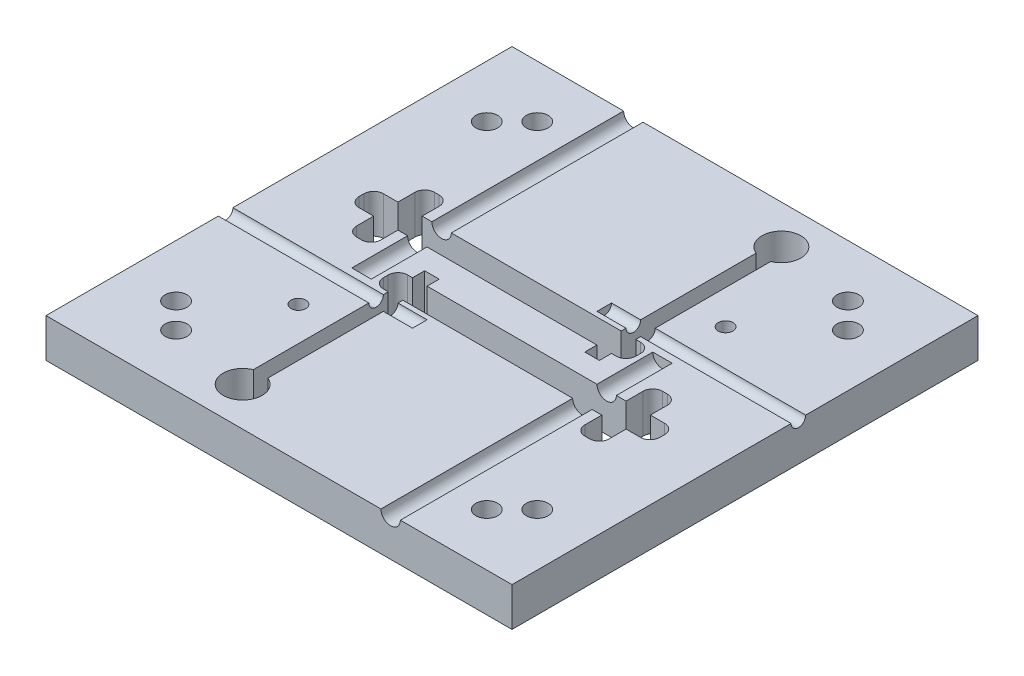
SolidWorks part; units mm, degrees
ref_plane "Front" through (0, 0, 0) normal (0, 0, 1) x (1, 0, 0)
ref_plane "Top" through (0, 0, 0) normal (0, 1, 0) x (1, 0, 0)
ref_plane "Right" through (0, 0, 0) normal (1, 0, 0) x (0, 0, -1)
sketch "Sketch1" plane through (0, 0, 0) normal (0, 1, 0) x (1, 0, 0)
  line L1 (-152.4, -152.4) -> (152.4, -152.4)
  line L2 (-152.4, -152.4) -> (-152.4, 152.4)
  line L3 (-152.4, 152.4) -> (152.4, 152.4)
  line L4 (152.4, -152.4) -> (152.4, 152.4)
  dimension "D1" = 304.8
  dimension "D2" = 304.8
  dimension "D3" = 152.4
  dimension "D4" = 152.4
extrude "Extrude1" add sketch "Sketch1" along normal mid plane 25.4
sketch "Sketch2" plane through (0, 12.7, 0) normal (0, 1, 0) x (-1, 0, 0)
  line L0 (0, 50) -> (0, -50) construction
  line L1 (50, 0) -> (-50, 0) construction
  circle A0 centre (118.11, -101.6) radius 7.1374
  circle A1 centre (-118.11, -101.6) radius 7.1374
  circle A2 centre (-101.6, -118.11) radius 7.1374
  circle A3 centre (101.6, -118.11) radius 7.1374
  dimension "D1" = 14.2748
  dimension "D5" = 14.2748
  dimension "D6" = 14.2748
  dimension "D7" = 101.6
  dimension "D8" = 101.6
  dimension "D9" = 118.11
  dimension "D10" = 118.11
  dimension "D2" = 101.6
  dimension "D3" = 118.11
  dimension "D4" = 118.11
extrude "Cut-Extrude1" cut sketch "Sketch2" against normal through all
mirror "Mirror1" about plane through (0, 0, 0) normal (0, 0, 1) of "Cut-Extrude1"
sketch "Sketch3" plane through (0, 12.7, 0) normal (0, 1, 0) x (-1, 0, 0)
  line L1 (101.6, -44.45) -> (85.725, -44.45)
  line L2 (101.6, -44.45) -> (101.6, 6.35)
  line L3 (101.6, 6.35) -> (85.725, 6.35)
  line L4 (85.725, -44.45) -> (85.725, 6.35)
  dimension "D1" = 50.8
  dimension "D2" = 15.875
  dimension "D3" = 101.6
  dimension "D4" = 44.45
extrude "Cut-Extrude2" cut sketch "Sketch3" against normal through all
fillet "Fillet1" radius 6.35 1 edges at (-101.6, 0, -44.45)
fillet "Fillet2" radius 6.35 1 edges at (-85.725, 0, -44.45)
fillet "Fillet3" radius 6.35 1 edges at (-101.6, 0, 6.35)
fillet "Fillet4" radius 6.35 1 edges at (-85.725, 0, 6.35)
ref_plane "Plane1" through (0, 12.7, 0) normal (0, 1, 0) x (-1, 0, 0)
sketch "Sketch5" plane through (0, 12.7, 0) normal (0, 1, 0) x (-1, 0, 0)
  line L1 (117.475, -11.0998) -> (38.1, -11.0998)
  line L2 (117.475, -11.0998) -> (117.475, -26.9748)
  line L3 (117.475, -26.9748) -> (38.1, -26.9748)
  line L4 (38.1, -11.0998) -> (38.1, -26.9748)
  dimension "D1" = 15.875
  dimension "D2" = 79.375
  dimension "D3" = 38.1
  dimension "D4" = 11.0998
extrude "Cut-Extrude4" cut sketch "Sketch5" against normal through all
fillet "Fillet5" radius 6.35 1 edges at (-117.475, 0, -26.9748)
fillet "Fillet6" radius 6.35 1 edges at (-117.475, 0, -11.0998)
fillet "Fillet7" radius 6.35 1 edges at (-38.1, 0, -26.9748)
fillet "Fillet8" radius 6.35 1 edges at (-38.1, 0, -11.0998)
sketch "Sketch6" plane through (0, 12.7, 0) normal (0, 1, 0) x (-1, 0, 0)
  line L0 (85.725, -11.0998) -> (44.45, -11.0998) construction
  line L1 (65.0875, -11.0998) -> (-63.5, -11.0998)
  line L2 (65.0875, -11.0998) -> (65.0875, -26.9748)
  line L3 (65.0875, -26.9748) -> (-63.5, -26.9748)
  line L4 (-63.5, -11.0998) -> (-63.5, -26.9748)
  dimension "D1" = 15.875
  dimension "D2" = 63.5
extrude "Cut-Extrude5" cut sketch "Sketch6" against normal through all
sketch "Sketch7" plane through (152.4, 0, 0) normal (1, 0, 0) x (0, 0, -1)
  line L0 (-152.4, 12.7) -> (152.4, 12.7) construction
  circle A0 centre (34.925, 12.7) radius 4.7625
  dimension "D2" = 9.525
  dimension "D1" = 34.925
extrude "Cut-Extrude6" cut sketch "Sketch7" against normal blind 127
sketch "Sketch8" plane through (0, 12.7, 0) normal (0, 1, 0) x (-1, 0, 0)
  line L1 (-53.975, -3.175) -> (-44.45, -3.175)
  line L2 (-53.975, -3.175) -> (-53.975, -130.175)
  line L3 (-53.975, -130.175) -> (-44.45, -130.175)
  line L4 (-44.45, -3.175) -> (-44.45, -130.175)
  dimension "D1" = 9.525
  dimension "D2" = 3.175
  dimension "D3" = 44.45
  dimension "D4" = 127
fillet "Fillet9" radius 6.35 1 edges at (63.5, 0, -26.9748)
fillet "Fillet10" radius 6.35 1 edges at (63.5, 0, -11.0998)
extrude "Cut-Extrude9" cut sketch "Sketch8" against normal through all from offset 12.7
sketch "Sketch9" plane through (0, 12.7, 0) normal (0, 1, 0) x (-1, 0, 0)
  circle A0 centre (-49.1998, -127) radius 12.7
  dimension "D1" = 25.4
  dimension "D2" = 127
  dimension "D3" = 49.1998
extrude "Cut-Extrude10" cut sketch "Sketch9" against normal through all
sketch "Sketch10" plane through (0, 0, -152.4) normal (0, 0, -1) x (-1, 0, 0)
  line L0 (-152.4, 12.7) -> (152.4, 12.7) construction
  circle A0 centre (73.025, 12.7) radius 6.35
  point P4 (0, 12.7)
  dimension "D1" = 12.7
  dimension "D2" = 73.025
extrude "Cut-Extrude11" cut sketch "Sketch10" against normal blind 177.8
sketch "Sketch11" plane through (0, 0, 152.4) normal (0, 0, 1) x (1, 0, 0)
  line L0 (-152.4, 12.7) -> (152.4, 12.7) construction
  circle A0 centre (73.025, 12.7) radius 6.35
  dimension "D1" = 12.7
  dimension "D2" = 73.025
extrude "Cut-Extrude12" cut sketch "Sketch11" against normal blind 177.8
sketch "Sketch12" plane through (0, 12.7, 0) normal (0, 1, 0) x (-1, 0, 0)
  line L1 (-85.725, -6.35) -> (-101.6, -6.35)
  line L2 (-85.725, -6.35) -> (-85.725, 44.45)
  line L3 (-85.725, 44.45) -> (-101.6, 44.45)
  line L4 (-101.6, -6.35) -> (-101.6, 44.45)
  dimension "D1" = 50.8
  dimension "D2" = 15.875
  dimension "D3" = 101.6
  dimension "D4" = 44.45
extrude "Cut-Extrude13" cut sketch "Sketch12" against normal through all
fillet "Fillet11" radius 6.35 1 edges at (85.725, 0, -6.35)
fillet "Fillet12" radius 6.35 1 edges at (101.6, 0, -6.35)
fillet "Fillet13" radius 6.35 1 edges at (101.6, 0, 44.45)
fillet "Fillet14" radius 6.35 1 edges at (85.725, 0, 44.45)
sketch "Sketch13" plane through (0, 12.7, 0) normal (0, 1, 0) x (-1, 0, 0)
  line L1 (-117.348, 26.9748) -> (-38.1, 26.9748)
  line L2 (-117.348, 26.9748) -> (-117.348, 11.0998)
  line L3 (-117.348, 11.0998) -> (-38.1, 11.0998)
  line L4 (-38.1, 26.9748) -> (-38.1, 11.0998)
  dimension "D1" = 15.875
  dimension "D2" = 11.0998
  dimension "D3" = 79.248
  dimension "D4" = 38.1
extrude "Cut-Extrude14" cut sketch "Sketch13" against normal through all
fillet "Fillet15" radius 6.35 1 edges at (117.348, 0, 11.0998)
fillet "Fillet16" radius 6.35 1 edges at (117.348, 0, 26.9748)
fillet "Fillet17" radius 6.35 1 edges at (38.1, 0, 26.9748)
fillet "Fillet18" radius 6.35 1 edges at (38.1, 0, 11.0998)
sketch "Sketch14" plane through (0, 12.7, 0) normal (0, 1, 0) x (-1, 0, 0)
  line L1 (63.5, 26.9748) -> (-51.2935, 26.9748)
  line L2 (63.5, 26.9748) -> (63.5, 11.0998)
  line L3 (63.5, 11.0998) -> (-51.2935, 11.0998)
  line L4 (-51.2935, 26.9748) -> (-51.2935, 11.0998)
  dimension "D1" = 15.875
  dimension "D2" = 63.5
  dimension "D3" = 11.0998
  dimension "D4" = 114.7935
extrude "Cut-Extrude15" cut sketch "Sketch14" against normal through all
fillet "Fillet19" radius 6.35 1 edges at (-63.5, 0, 11.0998)
fillet "Fillet20" radius 6.35 1 edges at (-63.5, 0, 26.9748)
sketch "Sketch15" plane through (-152.4, 0, 0) normal (-1, 0, 0) x (0, 0, 1)
  line L0 (-152.4, 12.7) -> (152.4, 12.7) construction
  circle A0 centre (34.925, 12.7) radius 4.7625
  dimension "D1" = 9.525
  dimension "D2" = 34.925
extrude "Cut-Extrude16" cut sketch "Sketch15" against normal blind 127
sketch "Sketch16" plane through (0, 12.7, 0) normal (0, 1, 0) x (-1, 0, 0)
  line L1 (53.975, 130.175) -> (44.45, 130.175)
  line L2 (53.975, 130.175) -> (53.975, 3.175)
  line L3 (53.975, 3.175) -> (44.45, 3.175)
  line L4 (44.45, 130.175) -> (44.45, 3.175)
  dimension "D1" = 127
  dimension "D2" = 3.175
  dimension "D3" = 9.525
  dimension "D4" = 44.45
extrude "Cut-Extrude17" cut sketch "Sketch16" against normal through all
sketch "Sketch17" plane through (0, 12.7, 0) normal (0, 1, 0) x (-1, 0, 0)
  circle A0 centre (49.1998, 127) radius 12.7
  dimension "D1" = 25.4
  dimension "D2" = 49.1998
  dimension "D3" = 127
extrude "Cut-Extrude18" cut sketch "Sketch17" against normal through all
sketch "Sketch18" plane through (0, 12.7, 0) normal (0, 1, 0) x (-1, 0, 0)
  circle A0 centre (-76.2, -63.5) radius 4.826
  circle A1 centre (76.2, 63.5) radius 4.826
  dimension "D1" = 9.652
  dimension "D6" = 9.652
  dimension "D2" = 63.5
  dimension "D3" = 76.2
  dimension "D4" = 76.2
  dimension "D5" = 63.5
extrude "Cut-Extrude19" cut sketch "Sketch18" against normal through all
